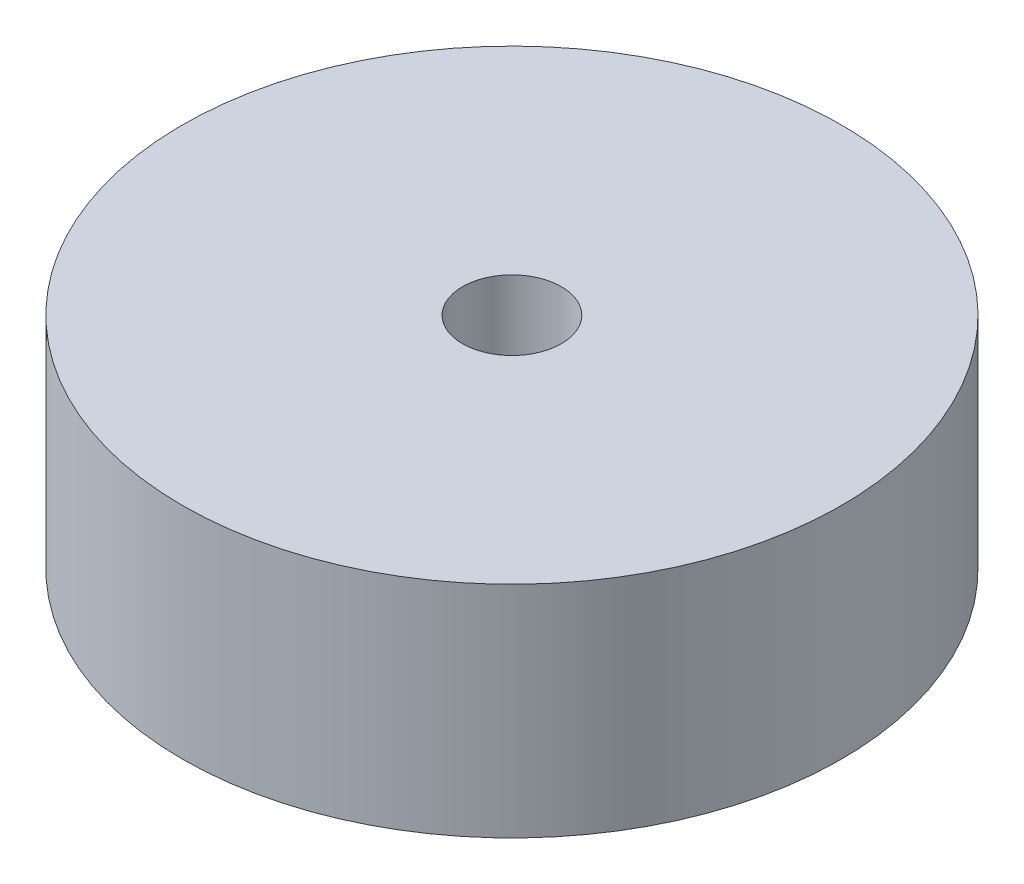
SolidWorks part; units mm, degrees
ref_plane "Front Plane" through (0, 0, 0) normal (0, 0, 1) x (1, 0, 0)
ref_plane "Top Plane" through (0, 0, 0) normal (0, 1, 0) x (1, 0, 0)
ref_plane "Right Plane" through (0, 0, 0) normal (1, 0, 0) x (0, 0, -1)
sketch "Sketch1" plane through (0, 0, 0) normal (0, 1, 0) x (1, 0, 0)
  circle A0 centre (0, 0) radius 2.25
  circle A1 centre (0, 0) radius 15
  dimension "D1" = 4.5
  dimension "D2" = 30
extrude "Extrude1" add sketch "Sketch1" along normal blind 10
